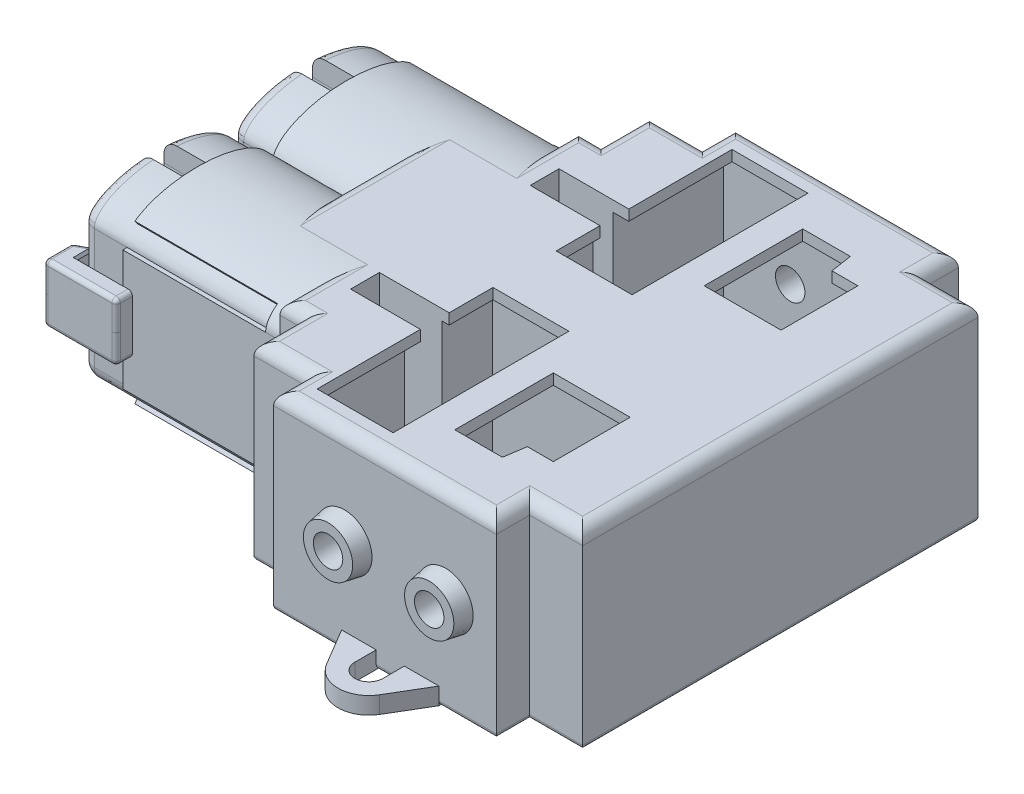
SolidWorks part; units mm, degrees
ref_plane "Front Plane" through (0, 0, 0) normal (0, 0, 1) x (1, 0, 0)
ref_plane "Top Plane" through (0, 0, 0) normal (0, 1, 0) x (1, 0, 0)
ref_plane "Right Plane" through (0, 0, 0) normal (1, 0, 0) x (0, 0, -1)
sketch "Sketch2" plane through (0, 0, 0) normal (0, 1, 0) x (1, 0, 0)
  line L1 (34.036, -23.5331) -> (-34.036, -23.5331)
  line L2 (34.036, -23.5331) -> (34.036, 23.5331)
  line L3 (34.036, 23.5331) -> (-34.036, 23.5331)
  line L4 (-34.036, -23.5331) -> (-34.036, 23.5331)
  line L5 (34.036, -23.5331) -> (-34.036, 23.5331) construction
  line L6 (34.036, 23.5331) -> (-34.036, -23.5331) construction
  point P0 (0, 0)
  dimension "D1" = 68.072
  dimension "D2" = 47.0662
extrude "Boss-Extrude1" add sketch "Sketch2" along normal blind 22.606
sketch "Sketch3" plane through (0, 22.606, 0) normal (0, 1, 0) x (1, 0, 0)
  line L1 (34.036, 23.5331) -> (-34.036, 23.5331) construction
  line L3 (-34.036, -23.5331) -> (34.036, -23.5331) construction
  line L4 (-5.08, 23.5331) -> (-5.08, 17.78)
  line L5 (-5.08, -23.5331) -> (-5.08, -17.78)
  line L6 (-5.08, -17.78) -> (-34.036, -17.78)
  line L7 (-34.036, 23.5331) -> (-34.036, -23.5331) construction
  line L8 (-34.036, -17.78) -> (-34.036, -23.5331)
  line L9 (-34.036, -23.5331) -> (-5.08, -23.5331)
  line L10 (-5.08, 17.78) -> (-34.036, 17.78)
  line L11 (-34.036, 17.78) -> (-34.036, 23.5331)
  line L12 (-34.036, 23.5331) -> (-5.08, 23.5331)
extrude "Cut-Extrude1" cut sketch "Sketch3" against normal blind 22.606
sketch "Sketch4" plane through (0, 0, 23.5331) normal (0, 0, 1) x (1, 0, 0)
  line L0 (-5.08, 22.606) -> (34.036, 22.606) construction
  line L1 (14.478, 22.606) -> (14.478, 0) construction
  line L2 (25.8864, 0) -> (-25.8864, 0) construction
  line L4 (27.7368, 0) -> (1.2192, 0)
  line L5 (27.7368, 0) -> (27.7368, 22.606)
  line L6 (27.7368, 22.606) -> (1.2192, 22.606)
  line L7 (1.2192, 0) -> (1.2192, 22.606)
  line L8 (27.7368, 0) -> (1.2192, 22.606) construction
  line L9 (27.7368, 22.606) -> (1.2192, 0) construction
  point P8 (14.478, 11.303)
  dimension "D1" = 26.5176
extrude "Boss-Extrude2" add sketch "Sketch4" along normal blind 3.9624
mirror "Mirror1" about plane through (0, 0, 0) normal (0, 0, 1) of "Boss-Extrude2"
sketch "Sketch7" plane through (-34.036, 0, 0) normal (-1, 0, 0) x (0, 0, 1)
  line L0 (0, 22.606) -> (17.78, 22.606) construction
  line L1 (-17.78, 22.606) -> (17.78, 22.606) construction
  line L3 (0, 22.606) -> (0, 18.4658) construction
  line L4 (0, -12.4334) -> (0, 12.4334) construction
  line L5 (17.78, 22.606) -> (17.78, 18.4658) construction
  line L6 (17.78, 0) -> (17.78, 22.606) construction
  line L7 (0, 18.4658) -> (0, 26.0858)
  line L8 (0, 26.0858) -> (17.78, 26.0858)
  line L9 (17.78, 26.0858) -> (17.78, 18.4658)
  ellipse E0 centre (8.89, 18.4658) end of major axis (17.78, 18.4658) minor radius 4.1402 (8.89, 22.606) -> (17.78, 18.4658) cw
  ellipse E1 centre (8.89, 18.4658) end of major axis (0, 18.4658) minor radius 4.1402 (8.89, 22.606) -> (0, 18.4658) ccw
extrude "Cut-Extrude2" cut sketch "Sketch7" against normal blind 28.956
sketch "Sketch8" plane through (-5.08, 0, 0) normal (-1, 0, 0) x (0, 0, 1)
  line L0 (17.78, 18.4658) -> (17.78, 22.606)
  line L1 (23.5331, 22.606) -> (8.89, 22.606) construction
  line L2 (17.78, 22.606) -> (8.89, 22.606)
  ellipse E0 centre (8.89, 18.4658) end of major axis (17.78, 18.4658) minor radius 4.1402 (8.89, 22.606) -> (17.78, 18.4658) cw
extrude "Boss-Extrude3" add sketch "Sketch8" along normal blind 2.667
sketch "Sketch9" plane through (-5.08, 0, 0) normal (-1, 0, 0) x (0, 0, 1)
  line L0 (8.89, 22.606) -> (0, 22.606)
  line L1 (0, -12.4334) -> (0, 12.4334) construction
  line L2 (0, 22.606) -> (8.89, 22.606) construction
  line L3 (0, 22.606) -> (0, 18.4658)
  ellipse E0 centre (8.89, 18.4658) end of major axis (17.78, 18.4658) minor radius 4.1402 (17.78, 18.4658) -> (0, 18.4658) ccw construction
  ellipse E1 centre (8.89, 18.4658) end of major axis (0, 18.4658) minor radius 4.1402 (8.89, 22.606) -> (0, 18.4658) ccw
extrude "Boss-Extrude4" add sketch "Sketch9" along normal blind 10.668
sketch "Sketch10" plane through (-34.036, 0, 0) normal (-1, 0, 0) x (0, 0, 1)
  line L0 (8.89, 22.606) -> (8.89, 0) construction
  line L1 (30.2451, 0) -> (-30.2451, 0) construction
  line L2 (4.0005, 11.303) -> (0, 11.303)
  line L3 (0, -12.4334) -> (0, 12.4334) construction
  line L4 (0, 11.303) -> (0, 18.4658)
  line L5 (13.7795, 11.303) -> (17.78, 11.303)
  line L6 (17.78, 0) -> (17.78, 22.606) construction
  line L7 (17.78, 11.303) -> (17.78, 18.4658)
  line L8 (8.89, 22.606) -> (8.89, 18.4658) construction
  arc A0 (4.0005, 11.303) -> (13.7795, 11.303) centre (8.89, 11.303) cw
  ellipse E0 centre (8.89, 18.4658) end of major axis (17.78, 18.4658) minor radius 4.1402 (17.78, 18.4658) -> (0, 18.4658) ccw construction
  ellipse E1 centre (8.89, 18.4658) end of major axis (17.78, 18.4658) minor radius 4.1402 (8.89, 22.606) -> (17.78, 18.4658) cw
  ellipse E2 centre (8.89, 18.4658) end of major axis (0, 18.4658) minor radius 4.1402 (8.89, 22.606) -> (0, 18.4658) ccw
extrude "Cut-Extrude3" cut sketch "Sketch10" against normal blind 2.159
sketch "Sketch13" plane through (-31.877, 0, 0) normal (-1, 0, 0) x (0, 0, 1)
  line L8 (0.508, 18.4658) -> (0.508, 11.303)
  line L10 (0, 11.303) -> (4.0005, 11.303) construction
  line L11 (17.272, 18.4658) -> (17.272, 11.303)
  line L12 (13.7795, 11.303) -> (17.78, 11.303) construction
  line L13 (17.272, 11.303) -> (17.78, 11.303)
  line L14 (17.78, 11.303) -> (17.78, 18.4658)
  line L15 (0.508, 11.303) -> (0, 11.303)
  line L16 (0, 11.303) -> (0, 18.4658)
  ellipse E1 centre (8.89, 18.4658) end of major axis (0, 18.4658) minor radius 4.1402 (17.78, 18.4658) -> (0, 18.4658) ccw construction
  ellipse E2 centre (8.89, 18.4658) end of major axis (17.78, 18.4658) minor radius 4.1402 (8.89, 22.606) -> (17.78, 18.4658) cw
  ellipse E3 centre (8.89, 18.4658) end of major axis (0, 18.4658) minor radius 4.1402 (8.89, 22.606) -> (0, 18.4658) ccw
  spline S0 degree 3 poles (1793.5462, -2392.587) (-220.5368, 28.2865) (23.5803, 4) (17.0531, 19.282) (16.9153, 19.4971) (16.5321, 19.928) (16.2868, 20.1432) (15.6957, 20.5552) (15.3501, 20.752) (14.185, 21.2946) (13.2366, 21.5913) (11.1551, 21.9928) (10.0227, 22.098) (7.7573, 22.098) (6.6249, 21.9928) (4.5434, 21.5913) (3.595, 21.2946) (2.4299, 20.752) (2.0843, 20.5552) (1.4932, 20.1432) (1.2479, 19.928) (0.8647, 19.4971) (0.7269, 19.282) (-5.8003, 4) (238.3169, 28.2865) (-1775.7681, -2392.5893) knots -4.465934 -4.465934 -4.465934 -4.465934 0.0625 0.0625 0.125 0.125 0.1875 0.1875 0.25 0.25 0.375 0.375 0.5 0.5 0.625 0.625 0.75 0.75 0.8125 0.8125 0.875 0.875 0.9375 0.9375 5.465935 5.465935 5.465935 5.465935 only from (17.272, 18.4658) to (0.508, 18.4658)
  spline S1 degree 3 poles (17.272, 18.4658) (17.272, 18.6654) (17.2309, 18.8659) (17.0531, 19.282) (16.9153, 19.4971) (16.5321, 19.928) (16.2868, 20.1432) (15.6957, 20.5552) (15.3501, 20.752) (14.185, 21.2946) (13.2366, 21.5913) (11.1551, 21.9928) (10.0227, 22.098) (7.7573, 22.098) (6.6249, 21.9928) (4.5434, 21.5913) (3.595, 21.2946) (2.4299, 20.752) (2.0843, 20.5552) (1.4932, 20.1432) (1.2479, 19.928) (0.8647, 19.4971) (0.7269, 19.282) (0.5491, 18.8659) (0.508, 18.6654) (0.508, 18.4658) knots 0 0 0 0 0.0625 0.0625 0.125 0.125 0.1875 0.1875 0.25 0.25 0.375 0.375 0.5 0.5 0.625 0.625 0.75 0.75 0.8125 0.8125 0.875 0.875 0.9375 0.9375 1 1 1 1
  dimension "D1" = 0.508
extrude "Cut-Extrude4" cut sketch "Sketch13" against normal blind 5.4356
sketch "Sketch14" plane through (-34.036, 0, 0) normal (-1, 0, 0) x (0, 0, 1)
  line L0 (4.0005, 11.303) -> (6.1595, 11.303)
  line L1 (6.1595, 11.303) -> (6.1595, 15.3591)
  arc A0 (13.7795, 11.303) -> (4.0005, 11.303) centre (8.89, 11.303) ccw construction
  arc A1 (6.1595, 15.3591) -> (4.0005, 11.303) centre (8.89, 11.303) ccw
extrude "Cut-Extrude5" cut sketch "Sketch14" against normal up to surface (2.159 mm away)
sketch "Sketch17" plane through (-34.036, 0, 0) normal (-1, 0, 0) x (0, 0, 1)
  line L0 (12.6442, 11.303) -> (14.0165, 11.303)
  line L1 (13.7795, 11.303) -> (17.78, 11.303) construction
  line L2 (12.9783, 11.6371) -> (14.0165, 11.6371)
  line L3 (14.0165, 11.6371) -> (14.0165, 11.303)
  arc A0 (12.6442, 11.303) -> (12.9783, 11.6371) centre (12.9783, 11.303) cw
extrude "Cut-Extrude10" cut sketch "Sketch17" against normal up to surface (2.159 mm away)
sketch "Sketch18" plane through (-34.036, 0, 0) normal (-1, 0, 0) x (0, 0, 1)
  line L1 (10.816, 14.1079) -> (10.816, 11.303)
  line L2 (10.816, 11.303) -> (11.69, 11.303)
  line L3 (11.69, 11.303) -> (11.69, 14.1079)
  arc A1 (11.69, 14.1079) -> (10.816, 14.1079) centre (11.253, 14.1079) ccw
extrude "Cut-Extrude11" cut sketch "Sketch18" against normal blind 6.9596
sketch "Sketch19" plane through (-34.036, 0, 0) normal (-1, 0, 0) x (0, 0, 1)
  line L0 (7.9248, 11.303) -> (9.8552, 11.303)
  arc A1 (9.8552, 11.303) -> (7.9248, 11.303) centre (8.89, 11.303) ccw
extrude "Boss-Extrude5" add sketch "Sketch19" along normal blind 1.016
sketch "Sketch21" plane through (0, 0, 17.78) normal (0, 0, 1) x (1, 0, 0)
  line L0 (-25.3057, 14.7574) -> (-26.4414, 14.7574)
  line L1 (-25.3057, 11.303) -> (-25.3057, 14.7574)
  line L3 (-26.4414, 11.303) -> (-26.4414, 18.4658) construction
  line L4 (-34.036, 11.303) -> (-33.9843, 11.3505)
  line L5 (-26.4414, 14.7574) -> (-26.4414, 11.303)
  line L6 (-26.4414, 11.303) -> (-25.3057, 11.303)
extrude "Boss-Extrude6" add sketch "Sketch21" along normal blind 1.9304 contours L6 L1 L0 M1
sketch "Sketch22" plane through (-26.4414, 0, 0) normal (-1, 0, 0) x (0, 0, 1)
  line L0 (19.7104, 14.7574) -> (17.8054, 14.7574)
  line L1 (17.8054, 14.7574) -> (17.8054, 11.303)
  line L2 (19.7104, 11.303) -> (17.78, 11.303) construction
  line L3 (17.8054, 11.303) -> (19.7104, 11.303)
  line L4 (19.7104, 11.303) -> (19.7104, 14.7574)
extrude "Boss-Extrude7" add sketch "Sketch22" along normal blind 7.5184
sketch "Sketch23" plane through (0, 0, 17.8054) normal (0, 0, -1) x (-1, 0, 0)
  line L0 (33.9598, 14.7574) -> (33.9598, 11.303)
  line L1 (33.9598, 11.303) -> (32.1738, 11.303)
  line L2 (33.9598, 11.303) -> (26.4414, 11.303) construction
  line L3 (32.1738, 11.303) -> (32.1738, 14.7574)
  line L4 (33.9598, 14.7574) -> (26.4414, 14.7574) construction
  line L5 (32.1738, 14.7574) -> (33.9598, 14.7574)
extrude "Boss-Extrude8" add sketch "Sketch23" along normal blind 2.4384
sketch "Sketch24" plane through (0, 14.7574, 0) normal (0, 1, 0) x (1, 0, 0)
  line L0 (-32.1738, -15.367) -> (-33.9598, -16.3461)
  line L1 (-32.1738, -15.367) -> (-32.1738, -17.8054) construction
  line L2 (-33.9598, -15.367) -> (-32.1738, -15.367) construction
  line L3 (-33.9598, -19.7104) -> (-33.9598, -15.367) construction
  line L4 (-33.9598, -16.3461) -> (-33.9598, -15.367)
  line L5 (-33.9598, -15.367) -> (-32.1738, -15.367)
extrude "Cut-Extrude12" cut sketch "Sketch24" against normal up to surface (3.4544 mm away)
sketch "Sketch25" plane through (-31.877, 0, 0) normal (-1, 0, 0) x (0, 0, 1)
  line L0 (0.508, 18.4658) -> (17.272, 18.4658) construction
  line L1 (0.508, 11.303) -> (0.508, 18.4658) construction
  line L2 (7.4385, 19.5355) -> (7.4385, 22.4784)
  line L3 (7.4385, 22.4784) -> (10.2325, 22.4784)
  line L4 (10.2325, 22.4784) -> (10.2325, 19.5355)
  arc A0 (10.2325, 19.5355) -> (7.4385, 19.5355) centre (8.8355, 19.5355) cw
  spline S0 degree 3 poles (0.508, 18.4658) (0.508, 18.6654) (0.5491, 18.8659) (0.7269, 19.282) (0.8647, 19.4971) (1.2479, 19.928) (1.4932, 20.1432) (2.0843, 20.5552) (2.4299, 20.752) (3.595, 21.2946) (4.5434, 21.5913) (6.6249, 21.9928) (7.7573, 22.098) (10.0227, 22.098) (11.1551, 21.9928) (13.2366, 21.5913) (14.185, 21.2946) (15.3501, 20.752) (15.6957, 20.5552) (16.2868, 20.1432) (16.5321, 19.928) (16.9153, 19.4971) (17.0531, 19.282) (17.2309, 18.8659) (17.272, 18.6654) (17.272, 18.4658) knots 0 0 0 0 0.0625 0.0625 0.125 0.125 0.1875 0.1875 0.25 0.25 0.375 0.375 0.5 0.5 0.625 0.625 0.75 0.75 0.8125 0.8125 0.875 0.875 0.9375 0.9375 1 1 1 1 construction
extrude "Cut-Extrude13" cut sketch "Sketch25" against normal up to surface (5.4356 mm away)
sketch "Sketch26" plane through (-26.4414, 0, 0) normal (-1, 0, 0) x (0, 0, 1)
  line L0 (16.0572, 20.3026) -> (16.5835, 21.0399)
  line L1 (17.272, 18.4658) -> (18.2435, 18.4658)
  line L2 (18.2435, 18.4658) -> (18.2079, 20.3026)
  line L3 (18.2079, 20.3026) -> (16.5835, 21.0399)
  spline S0 degree 3 poles (2436.92, -3158.0249) (-269.6196, 33.3022) (24.1972, 2.5556) (17.0531, 19.282) (16.9153, 19.4971) (16.5321, 19.928) (16.2868, 20.1432) (15.6957, 20.5552) (15.3501, 20.752) (14.185, 21.2946) (13.2366, 21.5913) (11.1551, 21.9928) (10.0227, 22.098) (7.7573, 22.098) (6.6249, 21.9928) (4.5434, 21.5913) (3.595, 21.2946) (2.4299, 20.752) (2.0843, 20.5552) (1.4932, 20.1432) (1.2479, 19.928) (0.8647, 19.4971) (0.7269, 19.282) (-6.4172, 2.5557) (287.3971, 33.3019) (-2419.1045, -3157.983) knots -4.899847 -4.899847 -4.899847 -4.899847 0.0625 0.0625 0.125 0.125 0.1875 0.1875 0.25 0.25 0.375 0.375 0.5 0.5 0.625 0.625 0.75 0.75 0.8125 0.8125 0.875 0.875 0.9375 0.9375 5.899825 5.899825 5.899825 5.899825 only from (17.272, 18.4658) to (0.508, 18.4658)
  spline S1 degree 3 poles (17.272, 18.4658) (17.272, 18.6654) (17.2309, 18.8659) (17.0531, 19.282) (16.9153, 19.4971) (16.5465, 19.9118) (16.3235, 20.1108) (16.0572, 20.3026) knots 0 0 0 0 0.0625 0.0625 0.125 0.125 0.182797 0.182797 0.182797 0.182797
  dimension "D1" = 0.508
extrude "Cut-Extrude20" cut sketch "Sketch26" against normal blind 16.9926
fillet "Fillet2" radius 1.524 6 edges
fillet "Fillet4" radius 0.508 7 edges at (-33.9598, 13.0302, 16.3461) (-33.0668, 14.7574, 15.8565) (-25.3057, 14.7574, 18.7452) (-25.3057, 13.0302, 19.7104) (-33.9598, 13.0302, 19.7104) (-33.9598, 14.7574, 18.0282) (-29.6328, 14.7574, 19.7104)
fillet "Fillet5" radius 0.508 1 edges at (-35.052, 12.2682, 8.89)
chamfer "Chamfer1" distance 0.508 angle 45 1 edges at (-34.036, 15.6951, 11.0385)
chamfer "Chamfer2" distance 0.508 angle 45 3 edges at (-32.1738, 14.7574, 16.8759) (-32.1738, 14.6086, 15.5367) (-32.1738, 12.7762, 15.367)
ref_plane "Mid Plane" through (0, 11.303, 0) normal (0, 1, 0) x (1, 0, 0)
mirror "Mirror37" of "Cut-Extrude12", "Cut-Extrude13", "Cut-Extrude20", "Chamfer1", "Chamfer2", "Cut-Extrude2", "Fillet5", "Fillet4", "Boss-Extrude8", "Boss-Extrude7", "Boss-Extrude6", "Boss-Extrude5", "Cut-Extrude11", "Cut-Extrude10", "Cut-Extrude5", "Cut-Extrude4", "Cut-Extrude3", "Boss-Extrude4", "Boss-Extrude3"
mirror "Mirror38" about plane through (0, 0, 0) normal (0, 0, 1) of "Mirror37", "Cut-Extrude2", "Boss-Extrude3", "Boss-Extrude4", "Cut-Extrude3", "Cut-Extrude4", "Cut-Extrude5", "Cut-Extrude10", "Cut-Extrude11", "Boss-Extrude7", "Cut-Extrude13", "Cut-Extrude20", "Fillet4", "Fillet5", "Chamfer1", "Chamfer2"
fillet "Fillet6" radius 1.524 20 edges at (-31.877, 11.303, 16.51) (-31.877, 11.303, 1.27) (-31.115, 11.303, 0.508) (-31.115, 11.303, 17.272)
fillet "Fillet7" radius 1.524 22 edges at (34.036, 22.606, 0) (-5.08, 22.606, -20.6566) (-7.747, 22.606, -13.335) (-6.4135, 22.606, -17.78) (-15.748, 22.606, 0) (-5.08, 22.606, 20.6566) (14.478, 22.606, 27.4955) (14.478, 22.606, -27.4955) (-6.4135, 22.606, 17.78) (-7.747, 22.606, 13.335)
fillet "Fillet8" radius 0.508 22 edges at (-5.08, 0, 20.6566) (-7.747, 0, 13.335) (-6.4135, 0, 17.78) (14.478, 0, 27.4955) (-15.748, 0, 0) (34.036, 0, 0) (14.478, 0, -27.4955) (-5.08, 0, -20.6566) (-6.4135, 0, -17.78) (-7.747, 0, -13.335)
sketch "Sketch27" plane through (0, 22.606, 0) normal (0, 1, 0) x (1, 0, 0)
  line L0 (3.5966, 24.6912) -> (3.5966, 12.4026)
  line L1 (3.5966, 24.6912) -> (12.6306, 24.6912)
  line L2 (3.5966, 8.9798) -> (3.5966, 3.7613)
  line L3 (3.5966, 3.7613) -> (12.6306, 3.7613)
  line L4 (12.6306, 24.6912) -> (12.6306, 3.7613)
  line L5 (3.5966, 8.9798) -> (-4.7081, 8.9798)
  line L6 (15.9974, 8.9798) -> (15.9974, 20.7072)
  line L7 (3.5966, 12.4026) -> (-4.7081, 12.4026)
  line L8 (-4.7081, 8.9798) -> (-4.7081, 12.4026)
  line L9 (15.9974, 20.7072) -> (21.6647, 20.7072)
  line L10 (21.6647, 20.7072) -> (22.0575, 18.1261)
  line L11 (22.0575, 18.1261) -> (25.1437, 18.1261)
  line L12 (25.1437, 18.1261) -> (25.1437, 8.9798)
  line L13 (25.1437, 8.9798) -> (15.9974, 8.9798)
extrude "Cut-Extrude21" cut sketch "Sketch27" against normal blind 29.21
mirror "Mirror39" about plane through (0, 0, 0) normal (0, 0, 1) of "Cut-Extrude21"
sketch "Sketch28" plane through (0, 0, 0) normal (0, -1, 0) x (1, 0, 0)
  line L0 (1.7272, 12.4026) -> (-4.7081, 12.4026)
  line L1 (3.5966, 12.4026) -> (-4.7081, 12.4026) construction
  line L2 (-4.7081, 12.4026) -> (-4.7081, 8.9798)
  line L3 (-4.7081, 8.9798) -> (2.7432, 8.9798)
  line L4 (-4.7081, 8.9798) -> (3.5966, 8.9798) construction
  line L5 (2.7432, 8.9798) -> (2.7432, 2.9559)
  line L6 (2.7432, 2.9559) -> (30.8174, 2.9559)
  line L7 (30.8174, 2.9559) -> (30.8174, 21.079)
  line L8 (30.8174, 21.079) -> (25.4551, 21.079)
  line L9 (25.4551, 21.079) -> (25.4551, 25.5589)
  line L10 (25.4551, 25.5589) -> (1.7272, 25.5589)
  line L11 (1.7272, 26.9875) -> (1.7272, 23.0251) construction
  line L12 (1.7272, 25.5589) -> (1.7272, 12.4026)
extrude "Cut-Extrude22" cut sketch "Sketch28" against normal blind 21.336
mirror "Mirror40" about plane through (0, 0, 0) normal (0, 0, 1) of "Cut-Extrude22"
sketch "Sketch29" plane through (0, 0, 0) normal (0, -1, 0) x (1, 0, 0)
  line L0 (15.106, 0) -> (15.106, 30.045) construction
  line L1 (12.5444, 0) -> (-12.5444, 0) construction
  line L2 (15.106, 30.045) -> (15.106, 31.72) construction
  line L3 (34.036, -23.5331) -> (34.036, 23.5331) construction
  line L4 (20.896, 27.4955) -> (18.2653, 31.9224)
  line L5 (9.316, 27.4955) -> (11.9467, 31.9224)
  line L6 (9.316, 27.4955) -> (9.316, 26.9875)
  line L7 (9.316, 26.9875) -> (13.431, 26.9875)
  line L8 (20.896, 26.9875) -> (20.896, 27.4955)
  line L9 (27.2288, 26.9875) -> (1.7272, 26.9875) construction
  line L10 (27.7368, 27.4955) -> (1.2192, 27.4955) construction
  line L11 (11.9467, 31.9224) -> (18.2653, 31.9224) construction
  line L12 (13.431, 30.045) -> (13.431, 26.9875)
  line L13 (16.781, 30.045) -> (16.781, 26.9875)
  line L14 (16.781, 26.9875) -> (20.896, 26.9875)
  arc A0 (11.9467, 31.9224) -> (18.2653, 31.9224) centre (15.106, 30.045) cw
  arc A1 (16.781, 30.045) -> (13.431, 30.045) centre (15.106, 30.045) ccw
  dimension "D1" = 3.35
  dimension "D5" = 2
  dimension "D2" = 31.72
  dimension "D3" = 18.93
  dimension "D4" = 11.58
extrude "Boss-Extrude9" add sketch "Sketch29" against normal blind 2.032
mirror "Mirror41" about plane through (0, 0, 0) normal (0, 0, 1) of "Boss-Extrude9"
sketch "Sketch33" plane through (0, 0, 27.4955) normal (0, 0, 1) x (1, 0, 0)
  line L3 (54.231, 11.303) -> (-54.231, 11.303) construction
  circle A0 centre (21.6944, 11.303) radius 3.2766
extrude "Boss-Extrude11" add sketch "Sketch33" along normal blind 1.9558
sketch "Sketch34" plane through (0, 0, 29.4513) normal (0, 0, 1) x (1, 0, 0)
  circle A1 centre (21.6944, 11.303) radius 1.7526
  dimension "D1" = 3.5052
extrude "Cut-Extrude24" cut sketch "Sketch34" against normal blind 8.3058
chamfer "Chamfer3" distance 1.9533 angle 10 1 edges at (24.971, 11.303, 29.4513)
pattern_linear "LPattern6" count 2 spacing 12.0396 along (-1, 0, 0) of "Boss-Extrude11", "Cut-Extrude24", "Chamfer3"
mirror "Mirror48" about plane through (0, 0, 0) normal (0, 0, 1) of "LPattern6", "Boss-Extrude11", "Cut-Extrude24", "Chamfer3"
sketch "Sketch35" plane through (0, 0, 2.9559) normal (0, 0, 1) x (1, 0, 0)
  line L1 (21.6944, 12.7695) -> (20.4244, 12.0362)
  line L2 (20.4244, 12.0362) -> (20.4244, 10.5698)
  line L3 (20.4244, 10.5698) -> (21.6944, 9.8365)
  line L4 (21.6944, 9.8365) -> (22.9644, 10.5698)
  line L5 (22.9644, 10.5698) -> (22.9644, 12.0362)
  line L6 (22.9644, 12.0362) -> (21.6944, 12.7695)
  circle A0 centre (21.6944, 11.303) radius 1.27 construction
extrude "Cut-Extrude25" cut sketch "Sketch35" against normal blind 10.8458
sketch "Sketch36" plane through (-26.4414, 0, 0) normal (-1, 0, 0) x (0, 0, 1)
  line L0 (-0.508, 18.1769) -> (0.508, 18.1769)
  line L1 (-0.508, 18.4658) -> (-0.508, 4.1402) construction
  line L2 (0.508, 4.1402) -> (0.508, 18.4658) construction
  line L3 (0.508, 18.1769) -> (0.508, 17.5749)
  line L4 (0.508, 17.5749) -> (-0.508, 17.5749)
  line L5 (-0.508, 17.5749) -> (-0.508, 18.1769)
extrude "Cut-Extrude26" cut sketch "Sketch36" against normal blind 12.446
mirror "Mirror46" about plane through (0, 11.303, 0) normal (0, 1, 0) of "Cut-Extrude26"
sketch "Sketch40" plane through (-26.4414, 0, 0) normal (-1, 0, 0) x (0, 0, 1)
  line L0 (-10.2325, 22.0489) -> (-10.2325, 19.5355)
  line L1 (-7.4385, 22.0406) -> (-7.4385, 19.5355)
  line L2 (7.4385, 22.0406) -> (7.4385, 19.5355)
  line L3 (10.2325, 22.0489) -> (10.2325, 19.5355)
  arc A0 (-10.2325, 22.0489) -> (-7.4385, 22.0406) centre (-8.8716, 9.9141) cw
  arc A1 (-10.2325, 19.5355) -> (-7.4385, 19.5355) centre (-8.8355, 19.5355) ccw
  arc A2 (7.4385, 22.0406) -> (10.2325, 22.0489) centre (8.8637, 12.5719) cw
  arc A3 (7.4385, 19.5355) -> (10.2325, 19.5355) centre (8.8355, 19.5355) ccw
extrude "Cut-Extrude29" cut sketch "Sketch40" against normal blind 1.524
mirror "Mirror47" about plane through (0, 11.303, 0) normal (0, 1, 0) of "Cut-Extrude29"
